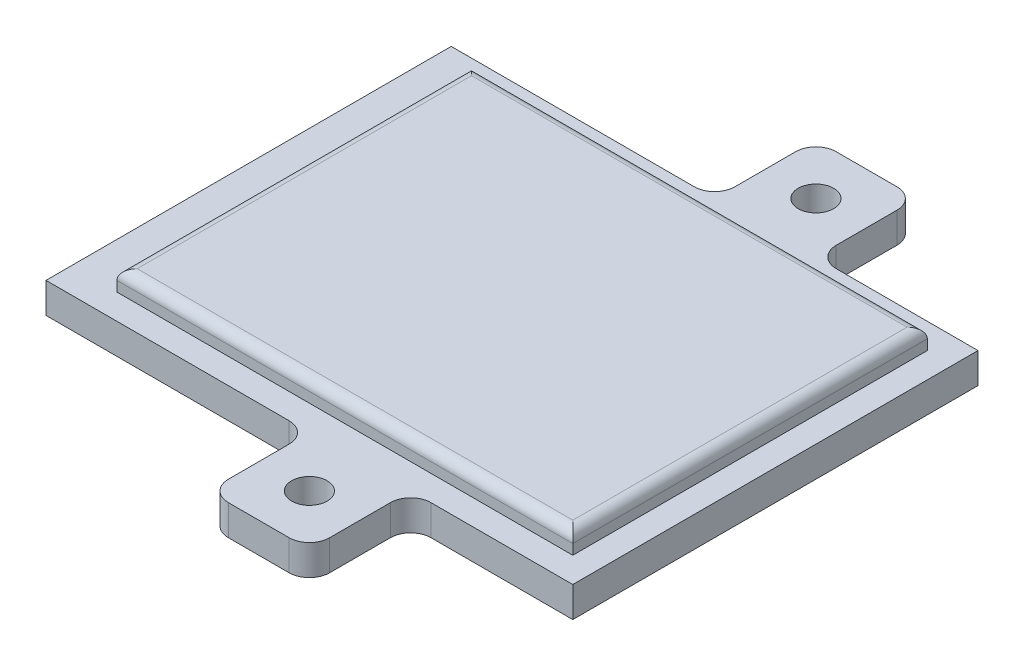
SolidWorks part; units mm, degrees
ref_plane "Front Plane" through (0, 0, 0) normal (0, 0, 1) x (1, 0, 0)
ref_plane "Top Plane" through (0, 0, 0) normal (0, 1, 0) x (1, 0, 0)
ref_plane "Right Plane" through (0, 0, 0) normal (1, 0, 0) x (0, 0, -1)
sketch "Sketch1" plane through (0, 0, 0) normal (0, 1, 0) x (1, 0, 0)
  line L1 (0, 0) -> (-52, 0)
  line L2 (0, 0) -> (0, 40)
  line L3 (0, 40) -> (-52, 40)
  line L4 (-52, 0) -> (-52, 40)
  line L5 (-26, 0) -> (-16, 0)
  line L6 (-26, 0) -> (-26, -10)
  line L7 (-26, -10) -> (-16, -10)
  line L8 (-16, 0) -> (-16, -10)
  line L9 (-26, 40) -> (-16, 40)
  line L10 (-26, 40) -> (-26, 50)
  line L11 (-26, 50) -> (-16, 50)
  line L12 (-16, 40) -> (-16, 50)
  dimension "D1" = 52
  dimension "D2" = 40
  dimension "D3" = 10
  dimension "D4" = 10
  dimension "D5" = 10
  dimension "D6" = 10
extrude "Boss-Extrude1" add sketch "Sketch1" along normal blind 3 contours L2 L1 L4 L3 | L10 L9 L12 L11 | L6 L5 L8 L7
sketch "Sketch2" plane through (0, 3, 0) normal (0, 1, 0) x (1, 0, 0)
  line L0 (-26, 0) -> (-52, 0) construction
  line L1 (-2.5, 37.5) -> (-47.5, 37.5)
  line L2 (-2.5, 37.5) -> (-2.5, 2.5)
  line L3 (-2.5, 2.5) -> (-47.5, 2.5)
  line L4 (-47.5, 37.5) -> (-47.5, 2.5)
  line L5 (0, 0) -> (0, 40) construction
  dimension "D1" = 35
  dimension "D2" = 45
  dimension "D3" = 2.5
  dimension "D4" = 2.5
extrude "Boss-Extrude2" add sketch "Sketch2" along normal blind 2
fillet "Fillet1" radius 1 4 edges at (-25, 5, -2.5) (-47.5, 5, -20) (-25, 5, -37.5) (-2.5, 5, -20)
sketch "Sketch3" plane through (0, 3, 0) normal (0, 1, 0) x (1, 0, 0)
  line L0 (-26, 50) -> (-16, 40)
  line L1 (-26, 0) -> (-16, -10)
  circle A0 centre (-21, 45) radius 1.75
  circle A1 centre (-21, -5) radius 1.75
  dimension "D1" = 3.5
  dimension "D2" = 3.5
extrude "Cut-Extrude1" cut sketch "Sketch3" against normal through all contours A0 | A1
fillet "Fillet2" radius 2 8 edges at (-16, 1.5, -40) (-16, 1.5, -50) (-26, 1.5, -50) (-26, 1.5, -40) (-26, 1.5, 10) (-26, 1.5, 0) (-16, 1.5, 10) (-16, 1.5, 0)
